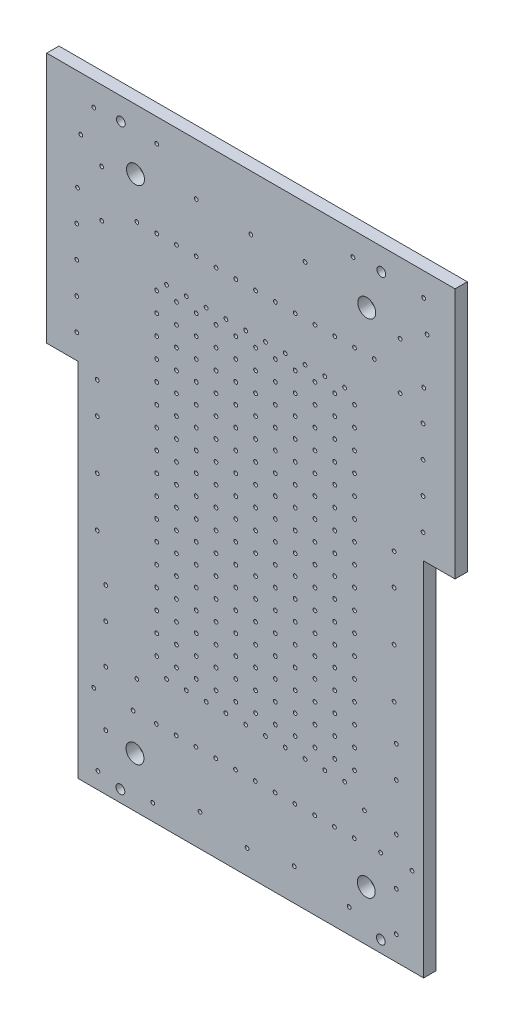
SolidWorks part; units mm, degrees
ref_plane "Front Plane" through (0, 0, 0) normal (0, 0, 1) x (1, 0, 0)
ref_plane "Top Plane" through (0, 0, 0) normal (0, 1, 0) x (1, 0, 0)
ref_plane "Right Plane" through (0, 0, 0) normal (1, 0, 0) x (0, 0, -1)
sketch "Sketch1" plane through (0, 0, 0) normal (0, 0, 1) x (1, 0, 0)
  line L0 (29.25, -3.29) -> (29.25, 25.92)
  line L1 (29.25, 25.92) -> (31.79, 25.92)
  line L2 (31.79, 25.92) -> (31.79, 46.24)
  line L3 (31.79, 46.24) -> (-1.23, 46.24)
  line L4 (-1.23, 46.24) -> (-1.23, 25.92)
  line L5 (-1.23, 25.92) -> (1.31, 25.92)
  line L6 (1.31, 25.92) -> (1.31, -3.29)
  line L7 (1.31, -3.29) -> (29.25, -3.29)
  circle A0 centre (5.95, 41.35) radius 0.7239
  circle A1 centre (24.65, 41.35) radius 0.7239
  circle A2 centre (4.77, 44.45) radius 0.3556
  circle A3 centre (25.83, 44.45) radius 0.3556
  circle A4 centre (18.785, -0.69) radius 0.1524
  circle A5 centre (14.975, -1.325) radius 0.1524
  circle A6 centre (11.165, -0.69) radius 0.1524
  circle A7 centre (2.91, -1.96) radius 0.1524
  circle A8 centre (7.355, -1.96) radius 0.1524
  circle A9 centre (23.23, -1.325) radius 0.1524
  circle A10 centre (27.04, -1.325) radius 0.1524
  circle A11 centre (3.545, 11.375) radius 0.1524
  circle A12 centre (3.545, 8.835) radius 0.1524
  circle A13 centre (27.04, 12.01) radius 0.1524
  circle A14 centre (27.04, 9.47) radius 0.1524
  circle A15 centre (28.31, 3.755) radius 0.1524
  circle A16 centre (27.04, 5.66) radius 0.1524
  circle A17 centre (25.77, 3.755) radius 0.1524
  circle A18 centre (27.04, 1.85) radius 0.1524
  circle A19 centre (3.545, 5.66) radius 0.1524
  circle A20 centre (2.58, 3.695) radius 0.1524
  circle A21 centre (3.545, 1.215) radius 0.1524
  circle A22 centre (5.755, 3.695) radius 0.1524
  circle A23 centre (27.345, 36.715) radius 0.1524
  circle A24 centre (27.345, 40.525) radius 0.1524
  circle A25 centre (2.58, 44.335) radius 0.1524
  circle A26 centre (7.66, 44.335) radius 0.1524
  circle A27 centre (29.25, 44.335) radius 0.1524
  circle A28 centre (23.535, 44.335) radius 0.1524
  circle A29 centre (15.28, 41.795) radius 0.1524
  circle A30 centre (3.215, 40.525) radius 0.1524
  circle A31 centre (3.215, 36.715) radius 0.1524
  circle A32 centre (29.53, 41.91) radius 0.1524
  circle A33 centre (1.53, 41.91) radius 0.1524
  circle A34 centre (26.86, 25.4) radius 0.1524
  circle A35 centre (2.86, 25.4) radius 0.1524
  circle A36 centre (29.2, 27.9) radius 0.1524
  circle A37 centre (1.2, 27.9) radius 0.1524
  circle A38 centre (29.2, 30.44) radius 0.1524
  circle A39 centre (1.2, 30.44) radius 0.1524
  circle A40 centre (29.2, 32.98) radius 0.1524
  circle A41 centre (1.2, 32.98) radius 0.1524
  circle A42 centre (23.66, 10.06) radius 0.1524
  circle A43 centre (23.66, 13.26) radius 0.1524
  circle A44 centre (23.66, 16.46) radius 0.1524
  circle A45 centre (23.66, 19.66) radius 0.1524
  circle A46 centre (23.66, 22.86) radius 0.1524
  circle A47 centre (23.66, 32.46) radius 0.1524
  circle A48 centre (22.06, 10.06) radius 0.1524
  circle A49 centre (22.06, 13.26) radius 0.1524
  circle A50 centre (22.06, 16.46) radius 0.1524
  circle A51 centre (22.06, 19.66) radius 0.1524
  circle A52 centre (22.06, 22.86) radius 0.1524
  circle A53 centre (22.06, 32.46) radius 0.1524
  circle A54 centre (20.46, 10.06) radius 0.1524
  circle A55 centre (20.46, 13.26) radius 0.1524
  circle A56 centre (20.46, 16.46) radius 0.1524
  circle A57 centre (20.46, 19.66) radius 0.1524
  circle A58 centre (20.46, 22.86) radius 0.1524
  circle A59 centre (20.46, 32.46) radius 0.1524
  circle A60 centre (18.86, 10.06) radius 0.1524
  circle A61 centre (18.86, 13.26) radius 0.1524
  circle A62 centre (18.86, 16.46) radius 0.1524
  circle A63 centre (18.86, 19.66) radius 0.1524
  circle A64 centre (18.86, 22.86) radius 0.1524
  circle A65 centre (18.86, 32.46) radius 0.1524
  circle A66 centre (17.26, 10.06) radius 0.1524
  circle A67 centre (17.26, 13.26) radius 0.1524
  circle A68 centre (17.26, 16.46) radius 0.1524
  circle A69 centre (17.26, 19.66) radius 0.1524
  circle A70 centre (17.26, 22.86) radius 0.1524
  circle A71 centre (17.26, 32.46) radius 0.1524
  circle A72 centre (15.66, 10.06) radius 0.1524
  circle A73 centre (15.66, 13.26) radius 0.1524
  circle A74 centre (15.66, 16.46) radius 0.1524
  circle A75 centre (15.66, 19.66) radius 0.1524
  circle A76 centre (15.66, 22.86) radius 0.1524
  circle A77 centre (15.66, 32.46) radius 0.1524
  circle A78 centre (14.06, 10.06) radius 0.1524
  circle A79 centre (14.06, 13.26) radius 0.1524
  circle A80 centre (14.06, 16.46) radius 0.1524
  circle A81 centre (23.66, 26.06) radius 0.1524
  circle A82 centre (14.06, 19.66) radius 0.1524
  circle A83 centre (23.66, 29.26) radius 0.1524
  circle A84 centre (14.06, 22.86) radius 0.1524
  circle A85 centre (14.06, 32.46) radius 0.1524
  circle A86 centre (22.06, 26.06) radius 0.1524
  circle A87 centre (12.46, 10.06) radius 0.1524
  circle A88 centre (22.06, 29.26) radius 0.1524
  circle A89 centre (12.46, 13.26) radius 0.1524
  circle A90 centre (20.46, 26.06) radius 0.1524
  circle A91 centre (12.46, 16.46) radius 0.1524
  circle A92 centre (20.46, 29.26) radius 0.1524
  circle A93 centre (12.46, 19.66) radius 0.1524
  circle A94 centre (18.86, 26.06) radius 0.1524
  circle A95 centre (12.46, 22.86) radius 0.1524
  circle A96 centre (23.635, 3.695) radius 0.1524
  circle A97 centre (24.46, 6.06) radius 0.1524
  circle A98 centre (26.86, 14.86) radius 0.1524
  circle A99 centre (26.86, 18.86) radius 0.1524
  circle A100 centre (26.86, 22.86) radius 0.1524
  circle A101 centre (12.46, 32.46) radius 0.1524
  circle A102 centre (25.26, 38.06) radius 0.1524
  circle A103 centre (29.26, 38.06) radius 0.1524
  circle A104 centre (19.66, 42.06) radius 0.1524
  circle A105 centre (10.86, 42.06) radius 0.1524
  circle A106 centre (2.86, 14.86) radius 0.1524
  circle A107 centre (2.86, 18.86) radius 0.1524
  circle A108 centre (2.86, 22.86) radius 0.1524
  circle A109 centre (18.86, 29.26) radius 0.1524
  circle A110 centre (1.26, 38.06) radius 0.1524
  circle A111 centre (10.86, 10.06) radius 0.1524
  circle A112 centre (6.06, 6.06) radius 0.1524
  circle A113 centre (22.035, 3.695) radius 0.1524
  circle A114 centre (20.435, 3.695) radius 0.1524
  circle A115 centre (18.835, 3.695) radius 0.1524
  circle A116 centre (17.235, 3.695) radius 0.1524
  circle A117 centre (15.635, 3.695) radius 0.1524
  circle A118 centre (14.035, 3.695) radius 0.1524
  circle A119 centre (12.435, 3.695) radius 0.1524
  circle A120 centre (10.835, 3.695) radius 0.1524
  circle A121 centre (9.235, 3.695) radius 0.1524
  circle A122 centre (7.635, 3.695) radius 0.1524
  circle A123 centre (22.06, 38.06) radius 0.1524
  circle A124 centre (23.66, 38.06) radius 0.1524
  circle A125 centre (20.46, 38.06) radius 0.1524
  circle A126 centre (18.86, 38.06) radius 0.1524
  circle A127 centre (17.26, 38.06) radius 0.1524
  circle A128 centre (15.66, 38.06) radius 0.1524
  circle A129 centre (14.06, 38.06) radius 0.1524
  circle A130 centre (12.46, 38.06) radius 0.1524
  circle A131 centre (10.86, 38.06) radius 0.1524
  circle A132 centre (9.26, 38.06) radius 0.1524
  circle A133 centre (7.66, 38.06) radius 0.1524
  circle A134 centre (6.06, 38.06) radius 0.1524
  circle A135 centre (23.66, 8.46) radius 0.1524
  circle A136 centre (17.26, 26.06) radius 0.1524
  circle A137 centre (23.66, 11.66) radius 0.1524
  circle A138 centre (10.86, 13.26) radius 0.1524
  circle A139 centre (23.66, 14.86) radius 0.1524
  circle A140 centre (17.26, 29.26) radius 0.1524
  circle A141 centre (23.66, 18.06) radius 0.1524
  circle A142 centre (10.86, 16.46) radius 0.1524
  circle A143 centre (23.66, 21.26) radius 0.1524
  circle A144 centre (15.66, 26.06) radius 0.1524
  circle A145 centre (23.66, 24.46) radius 0.1524
  circle A146 centre (23.66, 34.06) radius 0.1524
  circle A147 centre (22.06, 8.46) radius 0.1524
  circle A148 centre (10.86, 19.66) radius 0.1524
  circle A149 centre (22.06, 11.66) radius 0.1524
  circle A150 centre (15.66, 29.26) radius 0.1524
  circle A151 centre (22.06, 14.86) radius 0.1524
  circle A152 centre (10.86, 22.86) radius 0.1524
  circle A153 centre (22.06, 18.06) radius 0.1524
  circle A154 centre (10.86, 32.46) radius 0.1524
  circle A155 centre (22.06, 21.26) radius 0.1524
  circle A156 centre (14.06, 26.06) radius 0.1524
  circle A157 centre (22.06, 24.46) radius 0.1524
  circle A158 centre (22.06, 34.06) radius 0.1524
  circle A159 centre (20.46, 8.46) radius 0.1524
  circle A160 centre (9.26, 10.06) radius 0.1524
  circle A161 centre (20.46, 11.66) radius 0.1524
  circle A162 centre (14.06, 29.26) radius 0.1524
  circle A163 centre (20.46, 14.86) radius 0.1524
  circle A164 centre (9.26, 13.26) radius 0.1524
  circle A165 centre (20.46, 18.06) radius 0.1524
  circle A166 centre (12.46, 26.06) radius 0.1524
  circle A167 centre (20.46, 21.26) radius 0.1524
  circle A168 centre (9.26, 16.46) radius 0.1524
  circle A169 centre (20.46, 24.46) radius 0.1524
  circle A170 centre (20.46, 34.06) radius 0.1524
  circle A171 centre (18.86, 8.46) radius 0.1524
  circle A172 centre (12.46, 29.26) radius 0.1524
  circle A173 centre (18.86, 11.66) radius 0.1524
  circle A174 centre (9.26, 19.66) radius 0.1524
  circle A175 centre (18.86, 14.86) radius 0.1524
  circle A176 centre (10.86, 26.06) radius 0.1524
  circle A177 centre (18.86, 18.06) radius 0.1524
  circle A178 centre (9.26, 22.86) radius 0.1524
  circle A179 centre (18.86, 21.26) radius 0.1524
  circle A180 centre (9.26, 32.46) radius 0.1524
  circle A181 centre (18.86, 24.46) radius 0.1524
  circle A182 centre (18.86, 34.06) radius 0.1524
  circle A183 centre (17.26, 8.46) radius 0.1524
  circle A184 centre (10.86, 29.26) radius 0.1524
  circle A185 centre (17.26, 11.66) radius 0.1524
  circle A186 centre (7.66, 10.06) radius 0.1524
  circle A187 centre (17.26, 14.86) radius 0.1524
  circle A188 centre (9.26, 26.06) radius 0.1524
  circle A189 centre (17.26, 18.06) radius 0.1524
  circle A190 centre (7.66, 13.26) radius 0.1524
  circle A191 centre (17.26, 21.26) radius 0.1524
  circle A192 centre (9.26, 29.26) radius 0.1524
  circle A193 centre (17.26, 24.46) radius 0.1524
  circle A194 centre (17.26, 34.06) radius 0.1524
  circle A195 centre (15.66, 8.46) radius 0.1524
  circle A196 centre (7.66, 16.46) radius 0.1524
  circle A197 centre (15.66, 11.66) radius 0.1524
  circle A198 centre (7.66, 26.06) radius 0.1524
  circle A199 centre (15.66, 14.86) radius 0.1524
  circle A200 centre (7.66, 19.66) radius 0.1524
  circle A201 centre (15.66, 18.06) radius 0.1524
  circle A202 centre (7.66, 29.26) radius 0.1524
  circle A203 centre (15.66, 21.26) radius 0.1524
  circle A204 centre (7.66, 22.86) radius 0.1524
  circle A205 centre (15.66, 24.46) radius 0.1524
  circle A206 centre (15.66, 34.06) radius 0.1524
  circle A207 centre (14.06, 8.46) radius 0.1524
  circle A208 centre (7.66, 32.46) radius 0.1524
  circle A209 centre (14.06, 11.66) radius 0.1524
  circle A210 centre (29.2, 35.52) radius 0.1524
  circle A211 centre (14.06, 14.86) radius 0.1524
  circle A212 centre (1.2, 35.52) radius 0.1524
  circle A213 centre (14.06, 18.06) radius 0.1524
  circle A214 centre (23.66, 27.66) radius 0.1524
  circle A215 centre (14.06, 21.26) radius 0.1524
  circle A216 centre (23.66, 30.86) radius 0.1524
  circle A217 centre (14.06, 24.46) radius 0.1524
  circle A218 centre (14.06, 34.06) radius 0.1524
  circle A219 centre (12.46, 8.46) radius 0.1524
  circle A220 centre (22.06, 27.66) radius 0.1524
  circle A221 centre (12.46, 11.66) radius 0.1524
  circle A222 centre (22.06, 30.86) radius 0.1524
  circle A223 centre (12.46, 14.86) radius 0.1524
  circle A224 centre (20.46, 27.66) radius 0.1524
  circle A225 centre (12.46, 18.06) radius 0.1524
  circle A226 centre (20.46, 30.86) radius 0.1524
  circle A227 centre (12.46, 21.26) radius 0.1524
  circle A228 centre (18.86, 27.66) radius 0.1524
  circle A229 centre (12.46, 24.46) radius 0.1524
  circle A230 centre (12.46, 34.06) radius 0.1524
  circle A231 centre (10.86, 8.46) radius 0.1524
  circle A232 centre (18.86, 30.86) radius 0.1524
  circle A233 centre (10.86, 11.66) radius 0.1524
  circle A234 centre (17.26, 27.66) radius 0.1524
  circle A235 centre (10.86, 14.86) radius 0.1524
  circle A236 centre (17.26, 30.86) radius 0.1524
  circle A237 centre (10.86, 18.06) radius 0.1524
  circle A238 centre (15.66, 27.66) radius 0.1524
  circle A239 centre (10.86, 21.26) radius 0.1524
  circle A240 centre (15.66, 30.86) radius 0.1524
  circle A241 centre (10.86, 24.46) radius 0.1524
  circle A242 centre (10.86, 34.06) radius 0.1524
  circle A243 centre (9.26, 8.46) radius 0.1524
  circle A244 centre (14.06, 27.66) radius 0.1524
  circle A245 centre (9.26, 11.66) radius 0.1524
  circle A246 centre (14.06, 30.86) radius 0.1524
  circle A247 centre (9.26, 14.86) radius 0.1524
  circle A248 centre (12.46, 27.66) radius 0.1524
  circle A249 centre (9.26, 18.06) radius 0.1524
  circle A250 centre (12.46, 30.86) radius 0.1524
  circle A251 centre (9.26, 21.26) radius 0.1524
  circle A252 centre (10.86, 27.66) radius 0.1524
  circle A253 centre (9.26, 24.46) radius 0.1524
  circle A254 centre (9.26, 34.06) radius 0.1524
  circle A255 centre (7.66, 8.46) radius 0.1524
  circle A256 centre (10.86, 30.86) radius 0.1524
  circle A257 centre (7.66, 11.66) radius 0.1524
  circle A258 centre (9.26, 27.66) radius 0.1524
  circle A259 centre (7.66, 14.86) radius 0.1524
  circle A260 centre (9.26, 30.86) radius 0.1524
  circle A261 centre (7.66, 18.06) radius 0.1524
  circle A262 centre (7.66, 27.66) radius 0.1524
  circle A263 centre (7.66, 21.26) radius 0.1524
  circle A264 centre (7.66, 30.86) radius 0.1524
  circle A265 centre (7.66, 24.46) radius 0.1524
  circle A266 centre (7.66, 34.06) radius 0.1524
  circle A267 centre (22.86, 7.26) radius 0.1524
  circle A268 centre (21.26, 7.26) radius 0.1524
  circle A269 centre (19.66, 7.26) radius 0.1524
  circle A270 centre (18.06, 7.26) radius 0.1524
  circle A271 centre (16.46, 7.26) radius 0.1524
  circle A272 centre (14.86, 7.26) radius 0.1524
  circle A273 centre (13.26, 7.26) radius 0.1524
  circle A274 centre (11.66, 7.26) radius 0.1524
  circle A275 centre (10.06, 7.26) radius 0.1524
  circle A276 centre (8.46, 7.26) radius 0.1524
  circle A277 centre (22.86, 34.86) radius 0.1524
  circle A278 centre (21.26, 34.86) radius 0.1524
  circle A279 centre (19.66, 34.86) radius 0.1524
  circle A280 centre (18.06, 34.86) radius 0.1524
  circle A281 centre (16.46, 34.86) radius 0.1524
  circle A282 centre (14.86, 34.86) radius 0.1524
  circle A283 centre (13.26, 34.86) radius 0.1524
  circle A284 centre (11.66, 34.86) radius 0.1524
  circle A285 centre (10.06, 34.86) radius 0.1524
  circle A286 centre (8.46, 34.86) radius 0.1524
  circle A287 centre (24.61, 0.77) radius 0.7239
  circle A288 centre (5.91, 0.77) radius 0.7239
  circle A289 centre (25.79, -2.33) radius 0.3556
  circle A290 centre (4.73, -2.33) radius 0.3556
extrude "Boss-Extrude1" add sketch "Sketch1" against normal blind 0.991
